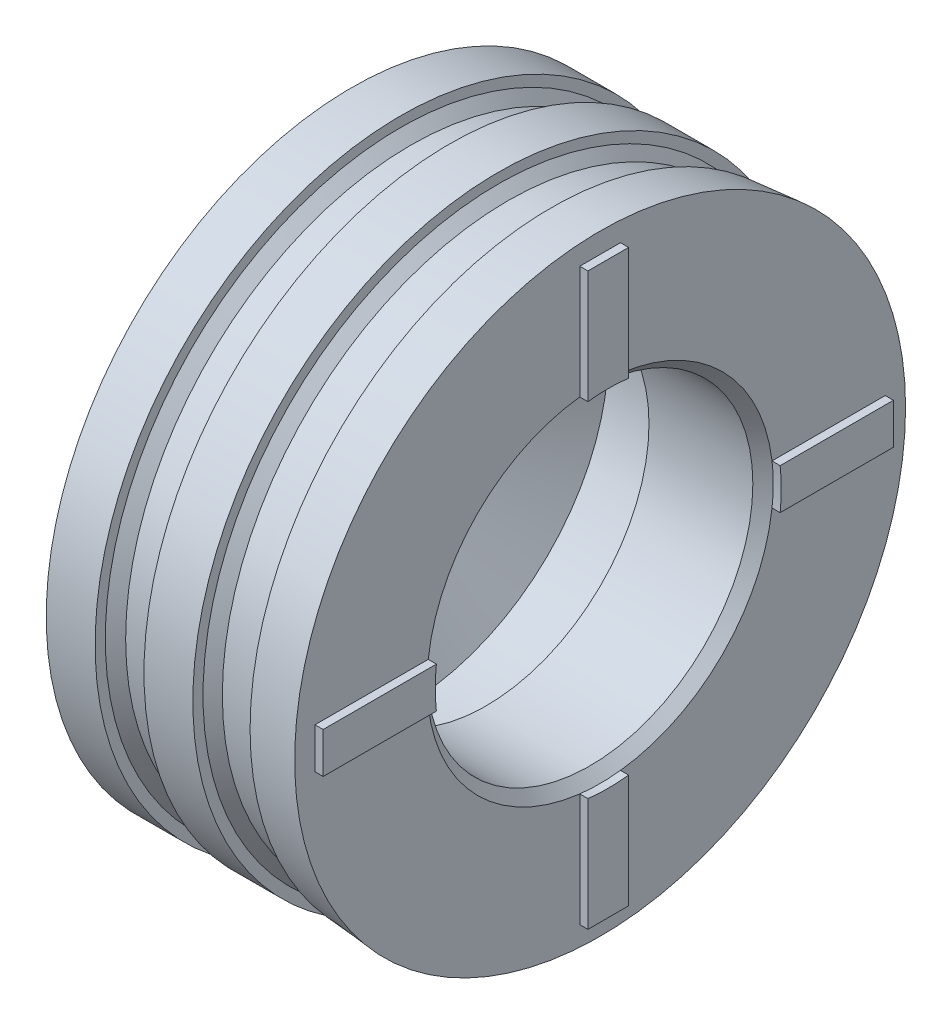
SolidWorks part; units mm, degrees
ref_plane "Front Plane" through (0, 0, 0) normal (0, 0, 1) x (1, 0, 0)
ref_plane "Top Plane" through (0, 0, 0) normal (0, 1, 0) x (1, 0, 0)
ref_plane "Right Plane" through (0, 0, 0) normal (1, 0, 0) x (0, 0, -1)
sketch "Sketch1" plane through (0, 0, 0) normal (0, 0, 1) x (1, 0, 0)
  line L0 (29.7944, 0) -> (-29.7944, 0) construction
  line L1 (0, 0) -> (2.9, 7.5)
  line L2 (2.9, 7.5) -> (4.1, 7.5)
  line L3 (4.1, 7.5) -> (4.1, 7.25)
  line L4 (4.35, 7) -> (5.3, 7)
  line L5 (5.3, 7) -> (5.3, 7.5)
  line L6 (5.3, 7.5) -> (6.5, 7.5)
  line L7 (6.5, 7.5) -> (6.5, 7.25)
  line L9 (7.8, 7.3075) -> (7.8, 7.395)
  line L10 (7.8, 7.395) -> (9, 7.5)
  line L11 (9, 7.5) -> (9, 4.25)
  line L12 (8.75, 4) -> (6.2, 4)
  line L13 (6.2, 4) -> (6.2, 5)
  line L14 (6.2, 5) -> (4.2, 5)
  line L15 (4.2, 5) -> (1.5, 0)
  line L16 (1.5, 0) -> (0, 0)
  line L17 (6.7371, 7.0129) -> (7.5636, 7.0579)
  line L18 (4.1, 7.25) -> (4.35, 7)
  line L19 (6.5, 7.25) -> (6.7371, 7.0129)
  line L20 (9, 4.25) -> (8.75, 4)
  arc A0 (7.5636, 7.0579) -> (7.8, 7.3075) centre (7.55, 7.3075) ccw
  point P4 (0, 0)
  point P9 (4.1, 7)
  point P13 (6.5, 7)
  point P17 (9, 4)
  dimension "D18" = 0.25
  dimension "D2" = 14
  dimension "D3" = 9
  dimension "D4" = 1.2
  dimension "D5" = 1.2
  dimension "D6" = 1.2
  dimension "D7" = 1.2
  dimension "D8" = 4.8
  dimension "D9" = 2.8
  dimension "D10" = 8
  dimension "D11" = 7.5
  dimension "D12" = 6.1
  dimension "D13" = 10
  dimension "D14" = 0.25
  dimension "D15" = 45
  dimension "D16" = 0.25
  dimension "D17" = 45
  dimension "D19" = 15
  dimension "D20" = 85
  dimension "D21" = 0.25
  dimension "D22" = 45
  dimension "D23" = 118.369
  dimension "D24" = 111.14
revolve "Revolve1" add sketch "Sketch1" angle 360 about L0
sketch "Sketch2" plane through (0, 0, 0) normal (1, 0, 0) x (0, 0, -1)
  line L0 (-22.1759, 0) -> (22.1759, 0) construction
  line L1 (0, -17.0171) -> (0, 17.0171) construction
  line L2 (0.712, -0.2667) -> (0.587, -0.4833)
  line L3 (-0.125, 0.75) -> (0.125, 0.75)
  line L4 (-0.125, 0.75) -> (-0.125, 6.75)
  line L5 (-0.125, 6.75) -> (0.125, 6.75)
  line L6 (0.125, 0.75) -> (0.125, 6.75)
  line L7 (-0.125, 0.75) -> (0.125, 6.75) construction
  line L8 (-0.125, 6.75) -> (0.125, 0.75) construction
  line L9 (0.712, -0.2667) -> (5.9082, -3.2667)
  line L10 (5.9082, -3.2667) -> (5.7832, -3.4833)
  line L11 (0.587, -0.4833) -> (5.7832, -3.4833)
  line L12 (0.712, -0.2667) -> (5.7832, -3.4833) construction
  line L13 (5.9082, -3.2667) -> (0.587, -0.4833) construction
  line L14 (-0.587, -0.4833) -> (-0.712, -0.2667)
  line L15 (-0.587, -0.4833) -> (-5.7832, -3.4833)
  line L16 (-5.7832, -3.4833) -> (-5.9082, -3.2667)
  line L17 (-0.712, -0.2667) -> (-5.9082, -3.2667)
  line L18 (-0.587, -0.4833) -> (-5.9082, -3.2667) construction
  line L19 (-5.7832, -3.4833) -> (-0.712, -0.2667) construction
  point P0 (0, 3.75)
  point P4 (0, 0)
  point P7 (0, 0)
  point P15 (3.2476, -1.875)
  point P16 (0, 0)
  point P17 (0, 0)
  point P22 (-3.2476, -1.875)
  point P23 (0, 0)
  point P24 (0, 0)
  point P29 (0, 0)
  dimension "D1" = 0.25
  dimension "D2" = 6
  dimension "D3" = 0.75
  dimension "D4" = 3
wrap "Wrap1" sketch "Sketch2" wrap type emboss source sketch "Sketch2" thickness 0.1 parameters "D1"=0.1
sketch "Sketch3" plane through (9, 0, 0) normal (1, 0, 0) x (0, 0, -1)
  line L0 (20.3701, 0) -> (-20.3701, 0) construction
  line L1 (0, -20.4037) -> (0, 20.4037) construction
  line L2 (-7, 0.5) -> (-7, -0.5)
  line L3 (-0.5, -7) -> (0.5, -7)
  line L4 (-0.5, -7) -> (-0.5, -0.5)
  line L5 (-0.5, 7) -> (0.5, 7)
  line L6 (0.5, -7) -> (0.5, -0.5)
  line L7 (-0.5, -7) -> (0.5, 7) construction
  line L8 (-0.5, 7) -> (0.5, -7) construction
  line L10 (7, 0.5) -> (7, -0.5)
  line L12 (0.5, 7) -> (-0.5, 7)
  line L13 (-0.5, 7) -> (-0.5, 0.5)
  line L14 (0.5, -7) -> (-0.5, -7)
  line L15 (0.5, 7) -> (0.5, 0.5)
  line L16 (7, -0.5) -> (7, 0.5)
  line L17 (7, 0.5) -> (0.5, 0.5)
  line L18 (-7, -0.5) -> (-7, 0.5)
  line L19 (7, -0.5) -> (0.5, -0.5)
  line L20 (-0.5, 0.5) -> (-0.5, 7)
  line L21 (-0.5, -0.5) -> (-0.5, -7)
  line L22 (0.5, -0.5) -> (7, -0.5)
  line L23 (-0.5, -0.5) -> (-7, -0.5)
  line L25 (0.5, 0.5) -> (7, 0.5)
  line L27 (-0.5, 0.5) -> (-7, 0.5)
  line L28 (0, -0.5) -> (0.02, -0.5)
  line L29 (0, 0.5) -> (0.02, 0.5)
  line L30 (0.5, 0.5) -> (0.5, 7)
  line L31 (0.5, -0.5) -> (0.5, -7)
  point P0 (0, 0)
  point P5 (0, 0)
  point P9 (0, 0)
  point P29 (0, 0)
  dimension "D1" = 1
  dimension "D2" = 14
  dimension "D3" = 4
extrude "Boss-Extrude1" add sketch "Sketch3" along normal blind 0.2 contours L27 L2 L23 M17 | L19 L10 L17 M17 | L15 L5 L13 M17 | L3 L6 L4 M17
